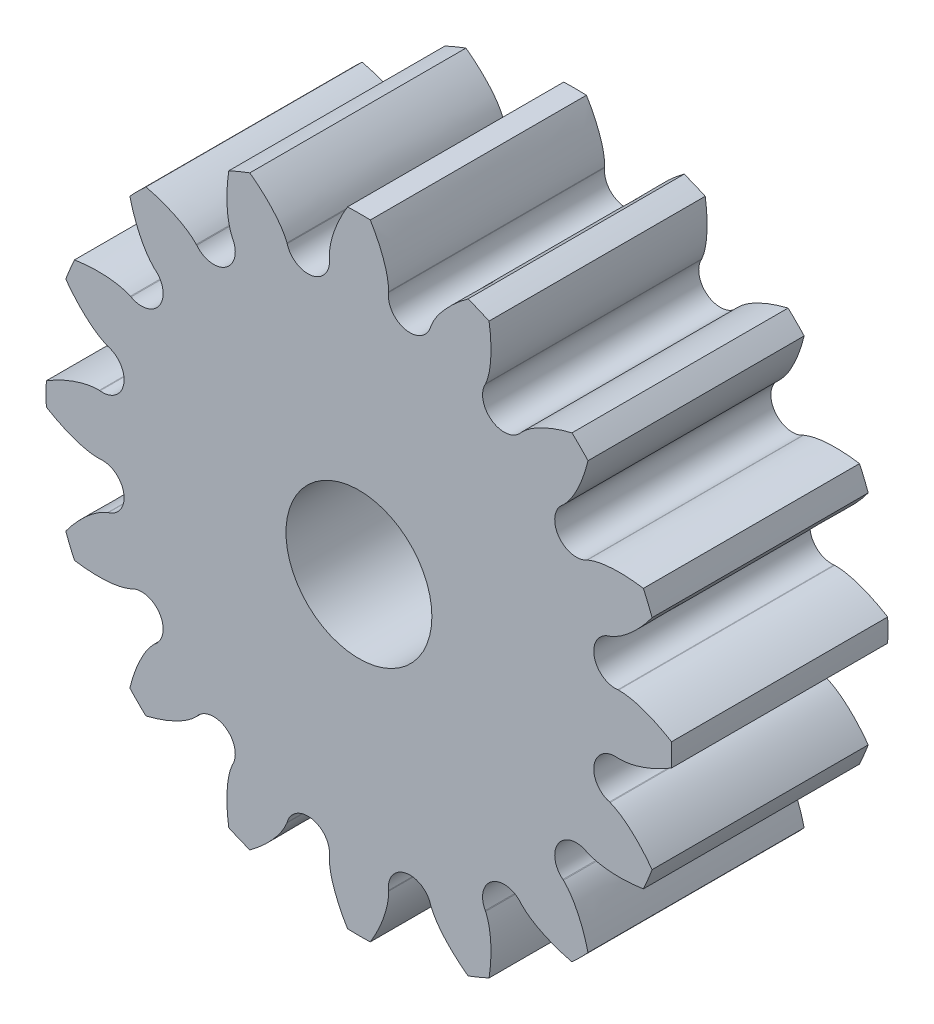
SolidWorks part; units mm, degrees
ref_plane "Front Plane" through (0, 0, 0) normal (0, 0, 1) x (1, 0, 0)
ref_plane "Top Plane" through (0, 0, 0) normal (0, 1, 0) x (1, 0, 0)
ref_plane "Right Plane" through (0, 0, 0) normal (1, 0, 0) x (0, 0, -1)
sketch "Involute construction sketch" plane through (0, 0, 0) normal (0, 0, 1) x (1, 0, 0)
  line L0 (0, 0) -> (-1.7946, 3.1652) construction
  line L1 (0, 0) -> (-1.096, 3.4696) construction
  line L2 (0, 0) -> (-0.3494, 3.6218) construction
  line L3 (0, 0) -> (0.4126, 3.6151) construction
  line L4 (-2.9284, 2.1595) -> (-2.4145, 2.722) construction
  line L5 (-2.4145, 2.722) -> (-1.7946, 3.1652) construction
  line L6 (-1.7946, 3.1652) -> (-1.096, 3.4696) construction
  line L7 (0, 0) -> (-2.4145, 2.722) construction
  line L8 (0, 0) -> (-2.9284, 2.1595) construction
  line L9 (-1.096, 3.4696) -> (-0.3494, 3.6218) construction
  line L10 (-0.3494, 3.6218) -> (0.4126, 3.6151) construction
  line L11 (-2.9284, 2.1595) -> (-0.6672, 5.2259) construction
  line L12 (-2.4145, 2.722) -> (-0.1342, 4.7446) construction
  line L13 (-1.7946, 3.1652) -> (0.194, 4.2927) construction
  line L14 (-1.096, 3.4696) -> (0.3572, 3.9286) construction
  line L15 (-0.3494, 3.6218) -> (0.4091, 3.6949) construction
  line L17 (0, 0) -> (0, 5.7859) construction
  line L18 (0, 0) -> (0.3795, 3.8534) construction
  line L19 (0, 0) -> (0.6516, 3.2759) construction
  circle A0 centre (0, 0) radius 3.3401 construction
  circle A1 centre (0, 0) radius 3.6386 construction
  circle A2 centre (0, 0) radius 3.8721 construction
  circle A3 centre (0, 0) radius 4.3561 construction
  spline S0 degree 3 poles (0.4126, 3.6151) (0.4138, 3.7219) (0.3608, 3.9584) (0.0805, 4.5656) (-0.328, 4.974) (-0.6672, 5.2259) knots 0 0 0 0 0.160058 0.360049 1 1 1 1 construction
  point P17 (0.1584, 4.3532)
sketch "Sketch2" plane through (0, 0, 0) normal (0, 0, 1) x (1, 0, 0)
  line L0 (0, 4.3561) -> (0, 3.3401)
  line L1 (0, 0) -> (0, 5.7859) construction
  line L2 (0.4126, 3.6151) -> (0.4114, 3.605)
  line L3 (0, 0) -> (0.4126, 3.6151) construction
  circle A0 centre (0, 0) radius 4.3561 construction
  circle A1 centre (0, 0) radius 3.3401 construction
  arc A2 (0, 4.3561) -> (0.1584, 4.3532) centre (0, 0) cw
  arc A3 (0, 3.3401) -> (0.6516, 3.2759) centre (0, 0) cw
  arc A4 (0.4114, 3.605) -> (0.6516, 3.2759) centre (0.7103, 3.5709) ccw
  spline S0 degree 3 poles (0.1584, 4.3532) (0.2397, 4.2197) (0.3556, 3.9815) (0.4138, 3.7219) (0.4126, 3.6151) knots 0 0 0 0 0.595051 1 1 1 1
sketch "Sketch3" plane through (0, 0, 0) normal (0, 0, 1) x (1, 0, 0)
  circle A0 centre (0, 0) radius 3.3401
  circle A1 centre (0, 0) radius 1.016
extrude "Base" add sketch "Sketch3" along normal blind 3.0099
extrude "Half tooth" add sketch "Sketch2" along normal up to surface (3.0099 mm away)
ref_plane "Midplane of half tooth" through (0, 0, 0) normal (-1, 0, 0) x (0, 0, 1)
mirror "Mirror of half tooth" about plane through (0, 0, 0) normal (-1, 0, 0) of "Half tooth"
pattern_circular "Pattern of tooth" count 16 over 360 of "Half tooth", "Mirror of half tooth"
equation "\"radtodeg\"= 180 / PI'radian to degree conversion [ ]"
equation "\"phi\"= 20'pressure angle [deg]"
equation "\"N\"= 16'number of teeth [teeth]"
equation "\"A\"= 0.343in'diameter of addendum circle [inch]"
equation "\"B\"= 0.263in'diameter of dedendum circle [inch]"
equation "\"P\"= ( \"N\" + 2 ) / \"A\"'diametral pitch [teeth/inch]"
equation "\"d\"= \"N\" / \"P\"'diameter of pitch circle [inch]"
equation "\"cp\"= PI / \"P\"'circular pitch [inch/teeth]"
equation "\"add\"= 1 / \"P\"'addendum [inch]"
equation "\"ded\"= - ( \"B\" - \"d\" ) / 2'dedendum [inch]"
equation "\"clear\"= \"ded\" - \"add\"'clearance [inch]"
equation "\"C\"= \"B\" + 2 * \"clear\"'diameter of clearance circle [inch]"
equation "\"h\"= \"add\" + \"ded\"'tooth height / whole depth [inch]"
equation "\"s\"= \"d\" * cos ( \"phi\" * 1 / \"radtodeg\" )'diameter of base circle [inch]"
equation "\"t\"= ( PI / 2 ) / \"P\"'tooth width at diameter of pitch circle diameter [inch]"
equation "\"alpha\"= ( \"t\" / ( \"d\" / 2 ) * \"radtodeg\" ) / 2'arc angle for half of tooth width at pitch circle diameter [inch]"
equation "\"bore\"= 0.0800'bore of hub [inch]"
equation "\"D4@Involute construction sketch\"= \"A\"'addendum circle"
equation "\"D3@Involute construction sketch\"= \"d\"'pitch circle"
equation "\"D2@Involute construction sketch\"= \"s\"'base circle"
equation "\"D1@Involute construction sketch\"= \"B\"'dedendum circle"
equation "\"seg\"= \"D5@Involute construction sketch\"'size of one involute segment [inch]"
equation "\"D6@Involute construction sketch\"=2*\"seg\""
equation "\"D7@Involute construction sketch\"=3*\"seg\""
equation "\"D8@Involute construction sketch\"=4*\"seg\""
equation "\"D9@Involute construction sketch\"=5*\"seg\""
equation "\"D10@Involute construction sketch\"=\"alpha\""
equation "\"D11@Involute construction sketch\"=2*\"alpha\""
equation "\"D1@Sketch3\"=\"B\""
equation "\"D1@CirPattern1\"=\"N\""
equation "\"D2@Sketch3\"=\"bore\""
equation "\"D1@Pattern of tooth\"=\"N\""
